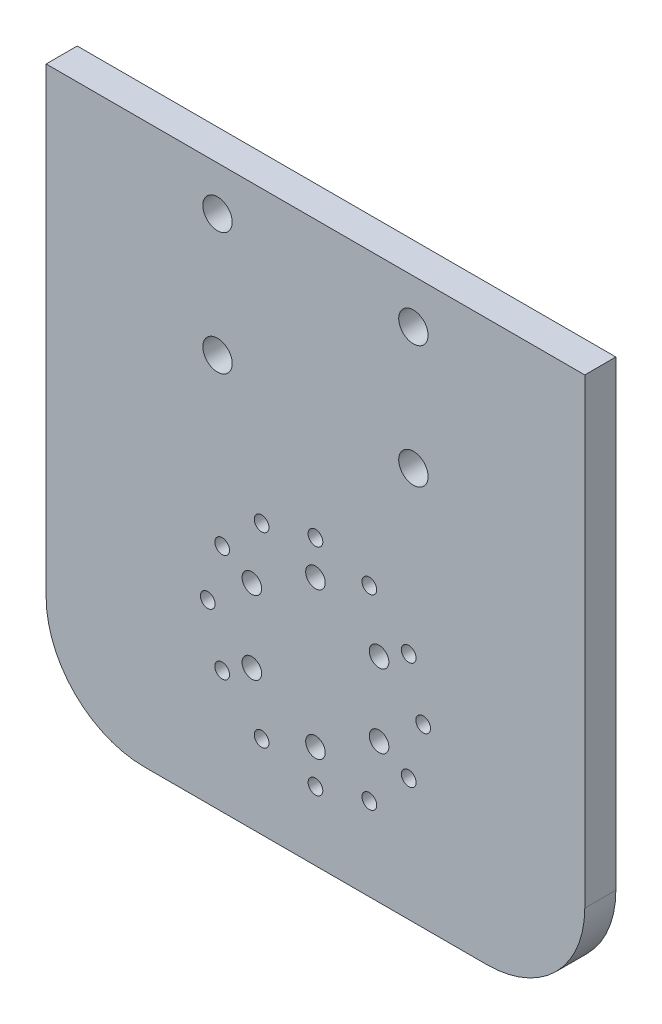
SolidWorks part; units mm, degrees
ref_plane "Front Plane" through (0, 0, 0) normal (1, 0, 0) x (0, 1, 0)
ref_plane "Top Plane" through (0, 0, 0) normal (0, 0, 1) x (0, 1, 0)
ref_plane "Right Plane" through (0, 0, 0) normal (0, 1, 0) x (-1, 0, 0)
sketch "Sketch1" plane through (0, 0, 0) normal (0, 0, 1) x (0, 1, 0)
  line L0 (0, 0) -> (15, 0) construction
  line L1 (0, 0) -> (22, 0) construction
  line L2 (20, 55) -> (20, -55) construction
  line L3 (-36, 55) -> (78.3, 55)
  line L5 (-36, -55) -> (78.3, -55)
  line L6 (78.3, 55) -> (78.3, -55)
  line L9 (-36, 55) -> (-36, -55)
  line L10 (44.3, 20) -> (69.3, 20) construction
  line L11 (69.3, 20) -> (69.3, -20) construction
  circle A1 centre (15, 0) radius 2
  circle A2 centre (7.5, -12.9904) radius 2
  circle A3 centre (-7.5, -12.9904) radius 2
  circle A4 centre (-15, 0) radius 2
  circle A5 centre (-7.5, 12.9904) radius 2
  circle A6 centre (7.5, 12.9904) radius 2
  circle A7 centre (22, 0) radius 1.5
  circle A8 centre (19.0526, -11) radius 1.5
  circle A9 centre (11, -19.0526) radius 1.5
  circle A10 centre (0, -22) radius 1.5
  circle A11 centre (-11, -19.0526) radius 1.5
  circle A12 centre (-19.0526, -11) radius 1.5
  circle A13 centre (-22, 0) radius 1.5
  circle A14 centre (-19.0526, 11) radius 1.5
  circle A15 centre (-11, 19.0526) radius 1.5
  circle A16 centre (0, 22) radius 1.5
  circle A17 centre (11, 19.0526) radius 1.5
  circle A18 centre (19.0526, 11) radius 1.5
  circle A19 centre (69.3, 20) radius 3
  circle A20 centre (44.3, 20) radius 3
  circle A21 centre (44.3, -20) radius 3
  circle A22 centre (69.3, -20) radius 3
  point P44 (78.3, 0)
  point P61 (69.3, 0)
  dimension "D2" = 4
  dimension "D5" = 3
  dimension "D12" = 6
  dimension "D3" = 15
  dimension "D6" = 22
  dimension "D8" = 25
  dimension "D9" = 110
  dimension "D10" = 40
  dimension "D11" = 6
  dimension "D13" = 20
  dimension "D14" = 44.3
  dimension "D15" = 114.3
  dimension "D4" = 6
  dimension "D7" = 12
extrude "Boss-Extrude1" add sketch "Sketch1" along normal blind 6.35
fillet "Fillet1" radius 20 2 edges at (-55, -36, 3.175) (55, -36, 3.175)
